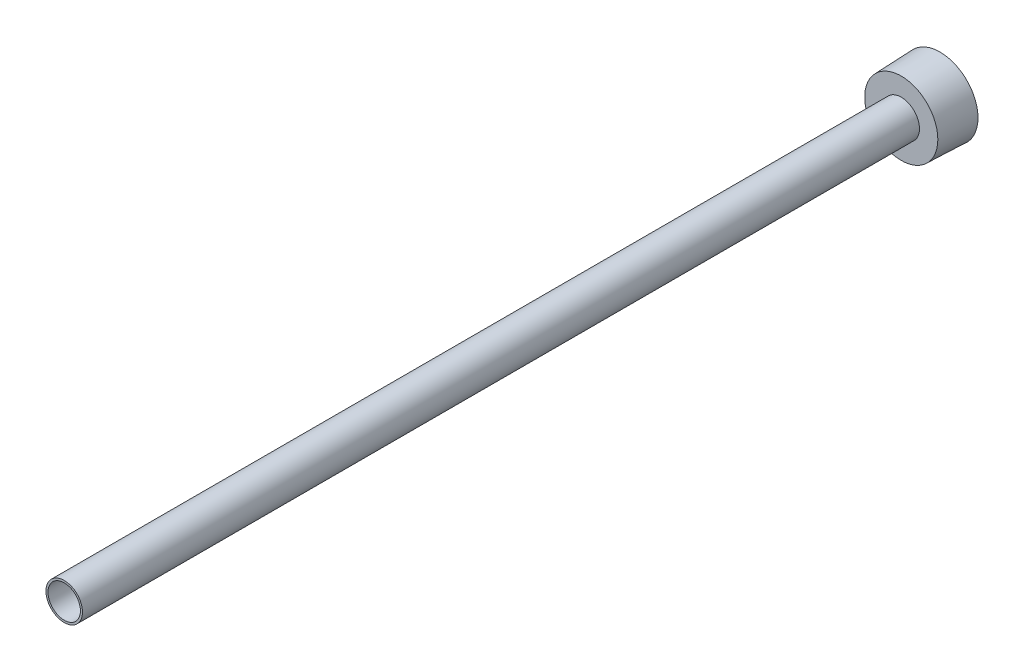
SolidWorks part; units mm, degrees
ref_plane "Front Plane" through (0, 0, 0) normal (0, 0, 1) x (1, 0, 0)
ref_plane "Top Plane" through (0, 0, 0) normal (0, 1, 0) x (1, 0, 0)
ref_plane "Right Plane" through (0, 0, 0) normal (1, 0, 0) x (0, 0, -1)
sketch "Sketch1" plane through (0, 0, 0) normal (1, 0, 0) x (0, 0, -1)
  line L0 (-278.0011, 0) -> (49721.9989, 0) construction
  line L1 (-304.8, 0) -> (0, 0)
  line L6 (0, 0) -> (0, 13.2207)
  line L7 (0, 13.2207) -> (-13.4874, 12.7287)
  line L8 (-13.4874, 12.7287) -> (-13.4874, 6.35)
  line L9 (-13.4874, 6.35) -> (-304.8, 6.35)
  line L10 (-304.8, 6.35) -> (-304.8, 0)
  dimension "D1" = 13.4874
  dimension "D2" = 26.4414
  dimension "D3" = 2.089
  dimension "D4" = 12.7
  dimension "D5" = 304.8
revolve "Revolve1" add sketch "Sketch1" angle 360 about L0
sketch "Sketch2" plane through (0, 0, 304.8) normal (0, 0, 1) x (1, 0, 0)
  circle A0 centre (0, 0) radius 5.6388
  dimension "D1" = 11.2776
extrude "Cut-Extrude1" cut sketch "Sketch2" against normal through all
sketch "Sketch3" plane through (0, 0, 0) normal (0, 0, -1) x (-1, 0, 0)
  line L0 (0, 14.5428) -> (0, -14.5428) construction
  line L1 (-9.525, -5.4993) -> (0, -10.9985)
  line L2 (0, -10.9985) -> (9.525, -5.4993)
  line L3 (9.525, -5.4993) -> (9.525, 5.4993)
  line L4 (9.525, 5.4993) -> (0, 10.9985)
  line L5 (0, 10.9985) -> (-9.525, 5.4993)
  line L6 (-9.525, 5.4993) -> (-9.525, -5.4993)
  circle A0 centre (0, 0) radius 9.525 construction
  dimension "D1" = 19.05
extrude "Cut-Extrude2" cut sketch "Sketch3" against normal blind 9.525
